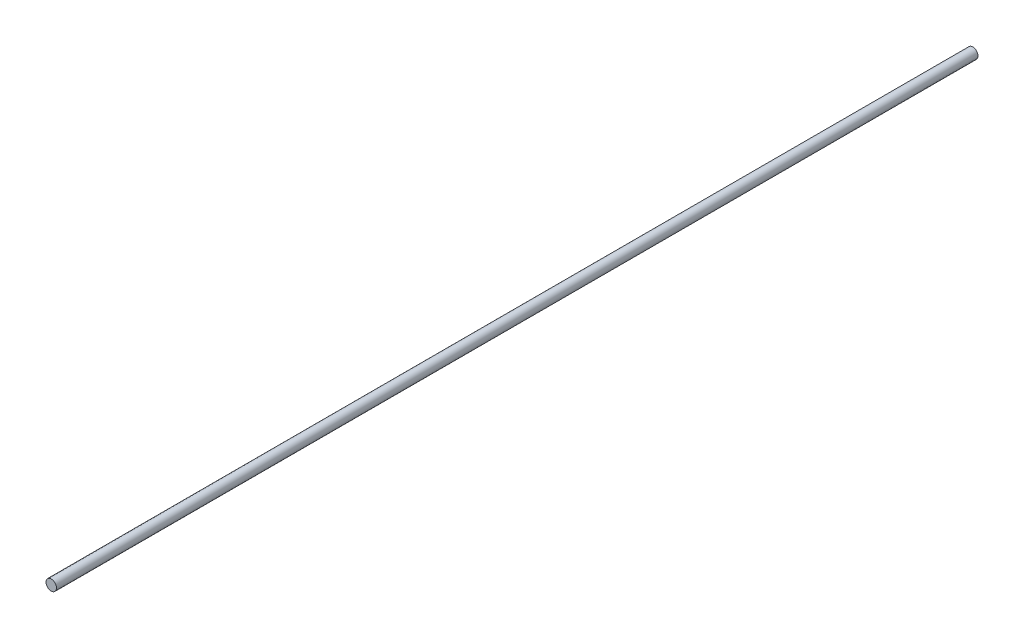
SolidWorks part; units mm, degrees
ref_plane "Alzado" through (0, 0, 0) normal (0, 0, 1) x (1, 0, 0)
ref_plane "Planta" through (0, 0, 0) normal (0, 1, 0) x (1, 0, 0)
ref_plane "Vista lateral" through (0, 0, 0) normal (1, 0, 0) x (0, 0, -1)
sketch "Croquis1" plane through (0, 0, 0) normal (0, 0, 1) x (1, 0, 0)
  circle A0 centre (0, 0) radius 2.5
  dimension "D1" = 5
extrude "Saliente-Extruir1" add sketch "Croquis1" along normal blind 440
